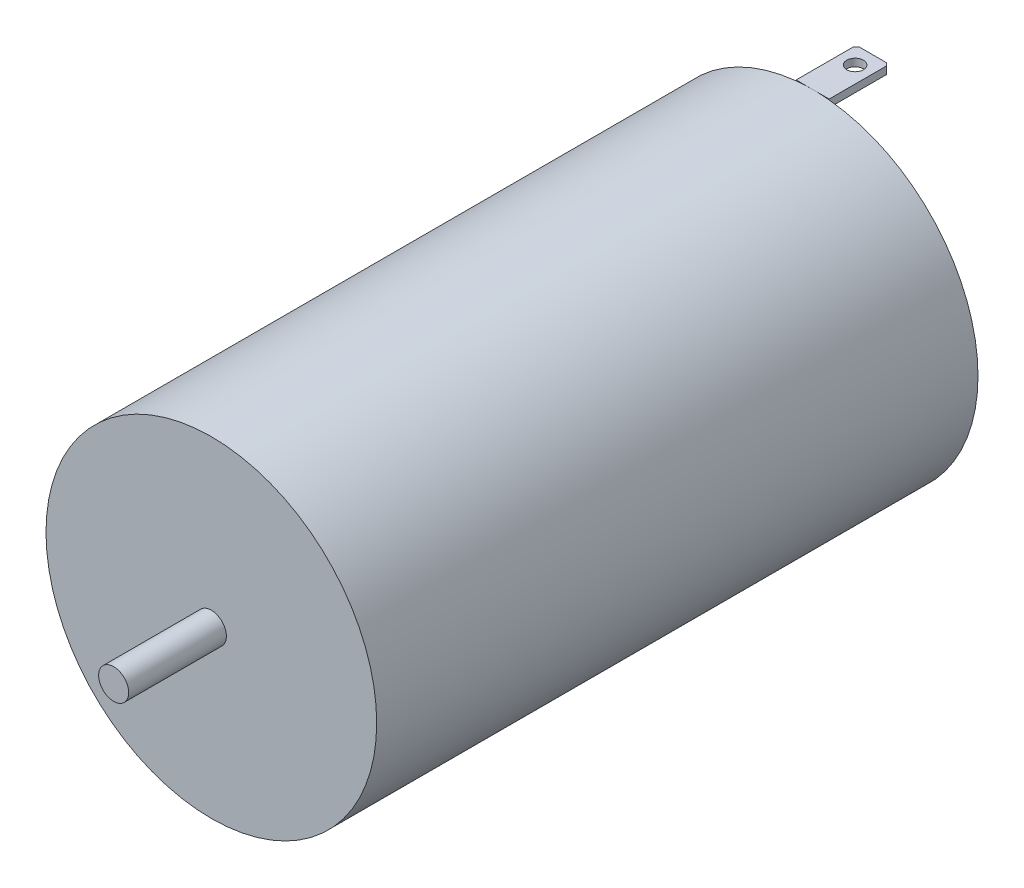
SolidWorks part; units mm, degrees
ref_plane "Plane1" through (0, 0, 0) normal (0, 0, 1) x (1, 0, 0)
ref_plane "Plane2" through (0, 0, 0) normal (0, 1, 0) x (1, 0, 0)
ref_plane "Plane3" through (0, 0, 0) normal (1, 0, 0) x (0, 0, -1)
sketch "Sketch1" plane through (0, 0, 0) normal (0, 0, 1) x (1, 0, 0)
  circle A0 centre (0, 0) radius 11
  dimension "D1" = 22
extrude "Base-Extrude" add sketch "Sketch1" along normal blind 40
sketch "Sketch2" plane through (0, 0, 40) normal (0, 0, 1) x (1, 0, 0)
  circle A0 centre (0, 0) radius 1
  dimension "D1" = 2
extrude "Boss-Extrude1" add sketch "Sketch2" along normal blind 6.5
ref_plane "Plane4" through (0, -11, 20) normal (0, -1, 0) x (-1, 0, 0)
sketch "Sketch3" plane through (0, -11, 20) normal (0, -1, 0) x (-1, 0, 0)
  line L0 (11, 20) -> (-11, 20) construction
  line L2 (-1.1, 20) -> (1.1, 20)
  line L3 (-1.1, 20) -> (-1.1, 24)
  line L4 (-1.1, 24) -> (1.1, 24)
  line L5 (1.1, 20) -> (1.1, 24)
  circle A0 centre (0, 22.8245) radius 0.5544
  point P6 (0, 24)
  dimension "D3" = 1.1087
  dimension "D4" = 1.1755
  dimension "D5" = 1.1
  dimension "D1" = 4
  dimension "D2" = 2.2
extrude "Extrude1" add sketch "Sketch3" against normal blind 0.5
chamfer "Chamfer1" distance 0.2 angle 45 2 edges at (-1.1, -10.75, -4) (1.1, -10.75, -4)
mirror "Mirror1" about plane through (0, 0, 0) normal (0, 1, 0) of "Chamfer1", "Extrude1"
